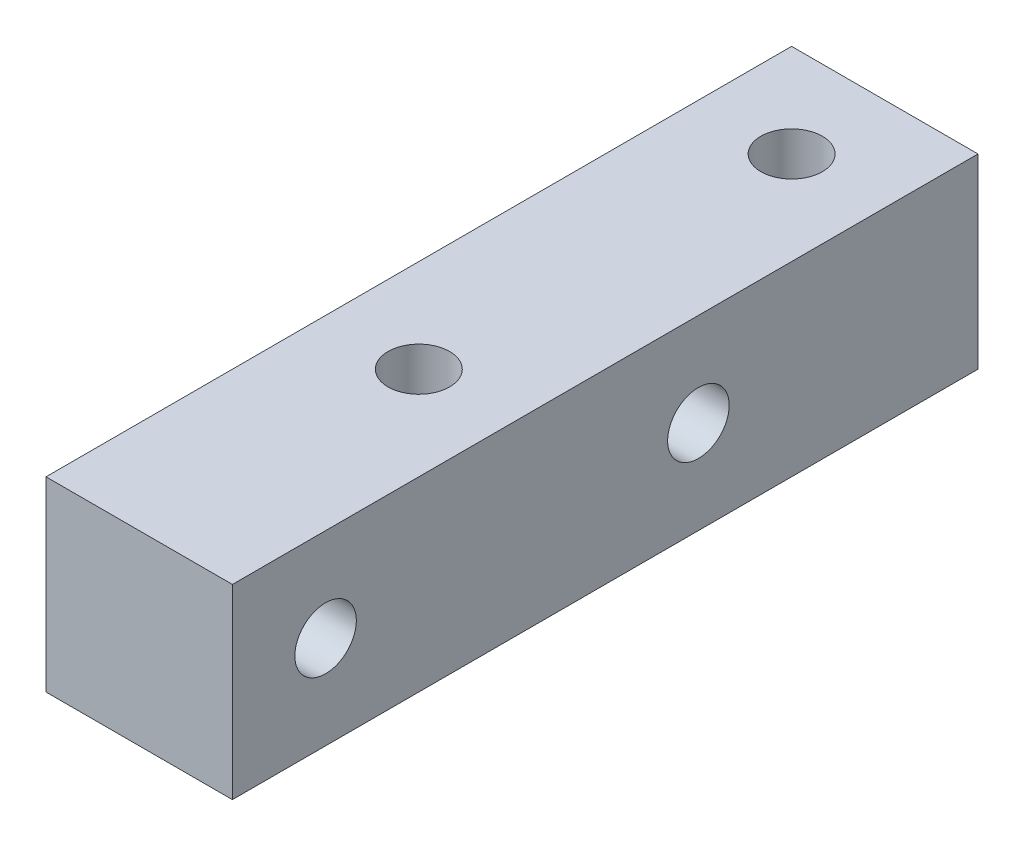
SolidWorks part; units mm, degrees
ref_plane "前视基准面" through (0, 0, 0) normal (0, 0, 1) x (1, 0, 0)
ref_plane "上视基准面" through (0, 0, 0) normal (0, 1, 0) x (1, 0, 0)
ref_plane "右视基准面" through (0, 0, 0) normal (1, 0, 0) x (0, 0, -1)
other "Configuration Table"
sketch "草图1" plane through (0, 0, 0) normal (0, 0, 1) x (1, 0, 0)
  line L1 (-5, 5) -> (5, 5)
  line L2 (-5, 5) -> (-5, -5)
  line L3 (-5, -5) -> (5, -5)
  line L4 (5, 5) -> (5, -5)
  line L5 (-5, 5) -> (5, -5) construction
  line L6 (-5, -5) -> (5, 5) construction
  point P0 (0, 0)
  dimension "D1" = 10
  dimension "D2" = 10
extrude "凸台-拉伸1" add sketch "草图1" along normal blind 40
hole_wizard "M4 螺纹孔1" positions "草图2" profile "草图3" tap size "M4" standard "GB"
sketch "草图2" plane through (0, 5, 0) normal (0, 1, 0) x (1, 0, 0)
  line L0 (5, 0) -> (-5, 0) construction
  point P0 (0, -5)
  point P2 (0, -25)
  dimension "D1" = 5
  dimension "D2" = 20
sketch "草图3" plane through (0, 5, 5) normal (1, 0, 0) x (0, 0, 1)
  line L0 (0, 0) -> (0, 10)
  line L1 (0, 10) -> (1.65, 10)
  line L2 (1.65, 10) -> (1.65, 0)
  line L5 (1.65, 0) -> (0, 0)
  line L11 (0, -6.35) -> (0, 107.95) construction
  dimension "通孔螺纹孔钻头直径" = 3.3
  dimension "通孔螺纹孔钻头深度" = 10
hole_wizard "M4 螺纹孔2" positions "草图4" profile "草图5" tap size "M4" standard "GB"
sketch "草图4" plane through (5, 0, 0) normal (1, 0, 0) x (0, 0, -1)
  line L1 (-40, -5) -> (-40, 5) construction
  line L2 (-40, 5) -> (0, 5) construction
  point P0 (-35, 0)
  point P2 (-15, 0)
  point P11 (-14.4543, 0)
  dimension "D1" = 5
  dimension "D2" = 25
  dimension "D3" = 5
  dimension "D4" = 5
sketch "草图5" plane through (5, 0, 35) normal (0, 1, 0) x (0, 0, -1)
  line L0 (0, 0) -> (0, 10)
  line L1 (0, 10) -> (1.65, 10)
  line L2 (1.65, 10) -> (1.65, 0)
  line L5 (1.65, 0) -> (0, 0)
  line L11 (0, -6.35) -> (0, 107.95) construction
  dimension "通孔螺纹孔钻头直径" = 3.3
  dimension "通孔螺纹孔钻头深度" = 10
